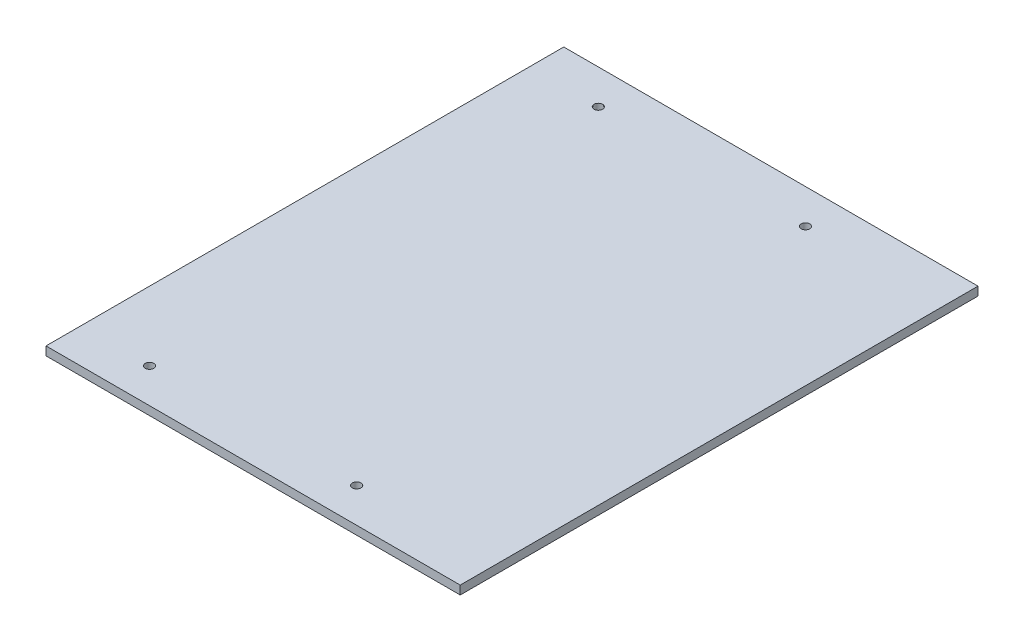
SolidWorks part; units mm, degrees
ref_plane "Front" through (0, 0, 0) normal (0, 0, 1) x (1, 0, 0)
ref_plane "Top" through (0, 0, 0) normal (0, 1, 0) x (1, 0, 0)
ref_plane "Right" through (0, 0, 0) normal (1, 0, 0) x (0, 0, -1)
sketch "스케치1" plane through (0, 0, 0) normal (0, 1, 0) x (1, 0, 0)
  line L0 (50.8, 95.25) -> (50.8, -95.25)
  line L1 (50.8, -95.25) -> (-101.6, -95.25)
  line L3 (50.8, 95.25) -> (-101.6, 95.25)
  line L4 (-101.6, -95.25) -> (-101.6, 95.25)
  line L5 (0, 95.25) -> (0, -95.25) construction
  line L6 (50.8, 0) -> (-101.6, 0) construction
  circle A1 centre (0, -82.55) radius 1.5875
  circle A2 centre (-76.2, -82.55) radius 1.5875
  circle A3 centre (-76.2, 82.55) radius 1.5875
  circle A4 centre (0, 82.55) radius 1.5875
  point P0 (0, 0)
  dimension "D12" = 3.175
  dimension "D13" = 3.175
  dimension "D15" = 3.175
  dimension "D16" = 3.175
  dimension "D1" = 190.5
  dimension "D4" = 12.7
  dimension "D5" = 12.7
  dimension "D6" = 25.4
  dimension "D8" = 25.4
  dimension "D9" = 12.7
  dimension "D10" = 12.7
extrude "보스-돌출1" add sketch "스케치1" along normal blind 3.175
